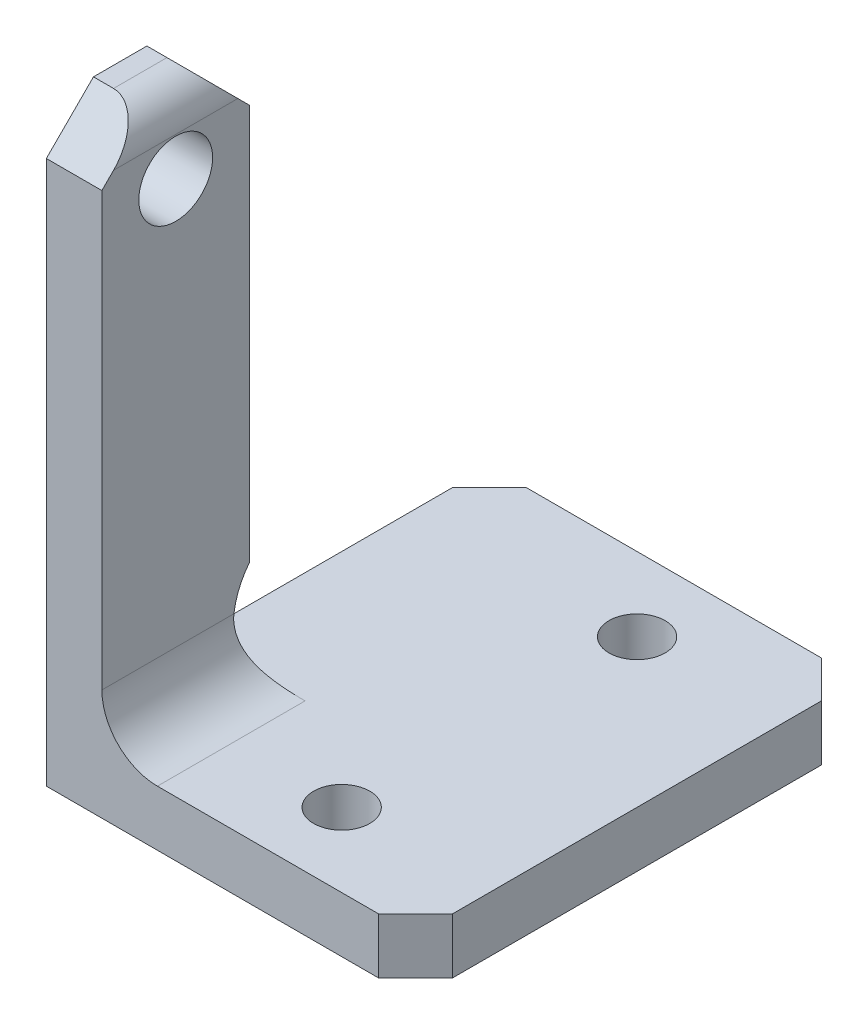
SolidWorks part; units mm, degrees
ref_plane "Plane1" through (0, 0, 0) normal (0, 0, 1) x (1, 0, 0)
ref_plane "Plane2" through (0, 0, 0) normal (0, 1, 0) x (1, 0, 0)
ref_plane "Plane3" through (0, 0, 0) normal (1, 0, 0) x (0, 0, -1)
sketch "Sketch1" plane through (0, 0, 0) normal (0, 0, 1) x (1, 0, 0)
  line L0 (0, 0) -> (0, 50.8)
  line L1 (0, 0) -> (31.75, 0)
  line L2 (9.5504, 4.7752) -> (31.75, 4.7752)
  line L3 (4.7752, 9.5504) -> (4.7752, 47.752)
  line L4 (31.75, 4.7752) -> (31.75, 0)
  line L5 (0, 50.8) -> (1.7272, 50.8)
  arc A0 (9.5504, 4.7752) -> (4.7752, 9.5504) centre (9.5504, 9.5504) cw
  arc A1 (4.7752, 47.752) -> (1.7272, 50.8) centre (1.7272, 47.752) ccw
  dimension "D4" = 4.7752
  dimension "D5" = 3.048
  dimension "D2" = 50.8
  dimension "D3" = 31.75
  dimension "D1" = 4.7752
extrude "Base-Extrude" add sketch "Sketch1" along normal blind 38.1
sketch "Sketch2" plane through (0, 4.7752, 0) normal (0, 1, 0) x (-1, 0, 0)
  line L0 (-31.75, 0) -> (-9.5504, 0) construction
  line L1 (0, 38.1) -> (0, 0) construction
  circle A0 centre (-19.05, 6.35) radius 2.413
  circle A1 centre (-19.05, 31.75) radius 2.413
  dimension "D1" = 4.826
  dimension "D2" = 6.35
  dimension "D3" = 25.4
  dimension "D4" = 19.05
extrude "#10-24UNC HELICOIL" cut sketch "Sketch2" against normal through all
sketch "Sketch3" plane through (4.7752, 0, 0) normal (1, 0, 0) x (0, 0, -1)
  line L0 (-38.1, 50.8) -> (0, 50.8) construction
  line L1 (-38.1, 4.7752) -> (0, 4.7752) construction
  line L2 (0, 9.5504) -> (0, 47.752) construction
  line L3 (-25.4, 50.8) -> (0, 50.8)
  line L4 (-25.4, 4.7752) -> (0, 4.7752)
  line L5 (0, 4.7752) -> (0, 50.8)
  line L6 (-25.4, 4.7752) -> (-25.4, 50.8)
  line L7 (-38.1, 0) -> (0, 0) construction
  line L8 (-38.1, 9.5504) -> (-38.1, 47.752) construction
  circle A0 centre (-31.75, 44.45) radius 3.175
  dimension "D2" = 44.45
  dimension "D3" = 6.35
  dimension "D4" = 6.35
  dimension "D1" = 25.4
extrude "Cut-Extrude2" cut sketch "Sketch3" against normal through all and the other way through all
chamfer "Chamfer1" distance 3.175 angle 45
chamfer "Chamfer2" distance 3.175 angle 45
sketch "Sketch4" plane through (0, 0, 0) normal (-1, 0, 0) x (0, 0, 1)
  line L0 (24.3359, 45.6832) -> (31.75, 53.0973)
  line L1 (31.75, 53.0973) -> (38.8555, 45.9918)
  line L2 (38.8555, 45.9918) -> (38.8555, 56.9048)
  line L3 (38.8555, 56.9048) -> (24.3359, 56.9048)
  line L4 (24.3359, 56.9048) -> (24.3359, 45.6832)
  line L5 (38.1, 50.8) -> (25.4, 50.8) construction
  dimension "D1" = 6.35
  dimension "D2" = 135
  dimension "D3" = 2.2973
extrude "Cut-Extrude3" cut sketch "Sketch4" against normal through all
sketch "Sketch5" plane through (0, 0, 0) normal (-1, 0, 0) x (0, 0, 1)
  line L0 (25.4, 46.7473) -> (25.4, 4.7752) construction
  line L1 (25.4, 4.7752) -> (3.175, 4.7752) construction
  line L2 (25.4, 12.7127) -> (25.4, 4.7752)
  arc A0 (25.4, 12.7127) -> (25.4, 4.7752) centre (20.443, 8.7439) cw
  dimension "D1" = 6.35
  dimension "D2" = 7.9375
extrude "EndcapRelief" cut sketch "Sketch5" against normal through all
